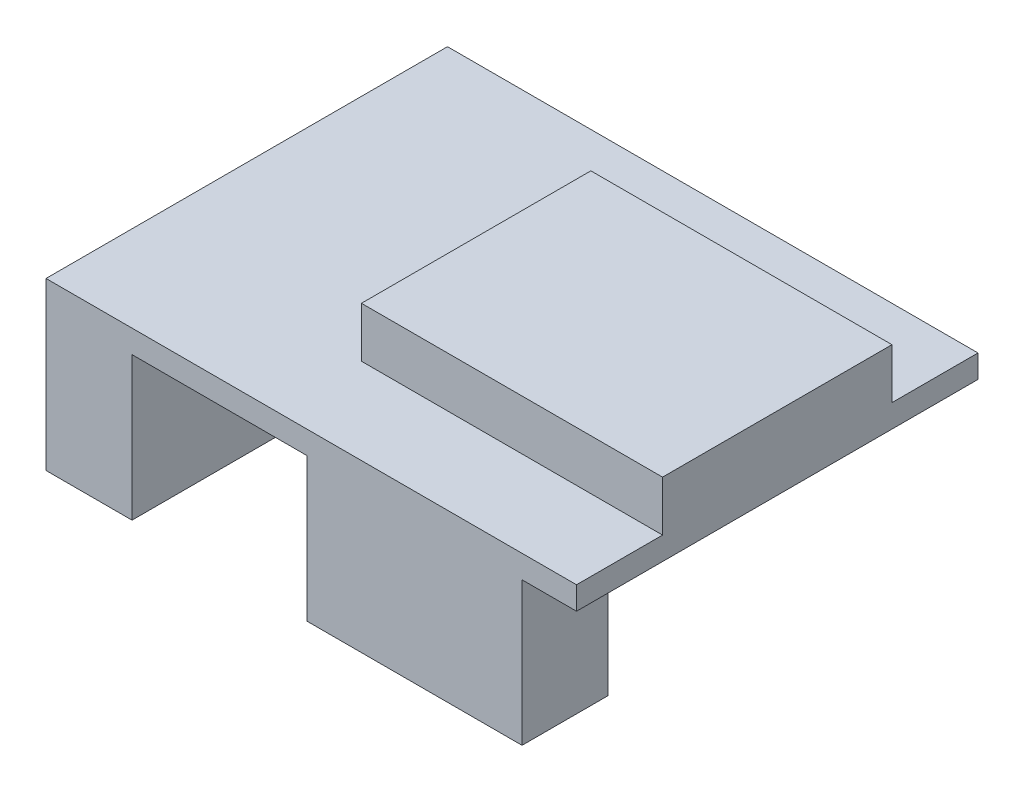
SolidWorks part; units mm, degrees
ref_plane "Спереди" through (0, 0, 0) normal (0, 0, 1) x (1, 0, 0)
ref_plane "Сверху" through (0, 0, 0) normal (0, 1, 0) x (1, 0, 0)
ref_plane "Справа" through (0, 0, 0) normal (1, 0, 0) x (0, 0, -1)
sketch "Эскиз1" plane through (0, 0, 0) normal (0, 1, 0) x (1, 0, 0)
  line L1 (-18.5, -14) -> (18.5, -14)
  line L2 (-18.5, -14) -> (-18.5, 14)
  line L3 (-18.5, 14) -> (18.5, 14)
  line L4 (18.5, -14) -> (18.5, 14)
  line L5 (-18.5, -14) -> (18.5, 14) construction
  line L6 (-18.5, 14) -> (18.5, -14) construction
  point P0 (0, 0)
  dimension "D1" = 37
  dimension "D2" = 28
extrude "Бобышка-Вытянуть1" add sketch "Эскиз1" along normal blind 1.6
sketch "Эскиз2" plane through (0, 1.6, 0) normal (0, 1, 0) x (1, 0, 0)
  line L0 (18.5, 0) -> (-18.5, 0) construction
  line L1 (18.5, -14) -> (18.5, 14) construction
  line L2 (-18.5, 14) -> (-18.5, -14) construction
  line L4 (-2.5, 8) -> (18.5, 8)
  line L5 (-2.5, 8) -> (-2.5, -8)
  line L6 (-2.5, -8) -> (18.5, -8)
  line L7 (18.5, 8) -> (18.5, -8)
  line L8 (-2.5, 8) -> (18.5, -8) construction
  line L9 (-2.5, -8) -> (18.5, 8) construction
  point P6 (8, 0)
  dimension "D1" = 21
  dimension "D2" = 16
extrude "Бобышка-Вытянуть2" add sketch "Эскиз2" along normal blind 3.5
sketch "Эскиз3" plane through (0, 1.6, 0) normal (0, 1, 0) x (1, 0, 0)
  line L6 (-18.5, -14) -> (18.5, -14) construction
  line L7 (-0.3, -14) -> (14.7, -14)
  line L8 (-0.3, -14) -> (-0.3, -8)
  line L9 (-0.3, -8) -> (14.7, -8)
  line L10 (14.7, -14) -> (14.7, -8)
  line L11 (18.5, -14) -> (18.5, -8) construction
  line L13 (-18.5, -14) -> (-12.5, -14)
  line L14 (-18.5, -14) -> (-18.5, 1)
  line L15 (-18.5, 1) -> (-12.5, 1)
  line L16 (-12.5, -14) -> (-12.5, 1)
  line L17 (-18.5, 14) -> (-12.5, 14)
  line L18 (-18.5, 14) -> (-18.5, 6.5868)
  line L19 (-18.5, 6.5868) -> (-12.5, 6.5868)
  line L20 (-12.5, 14) -> (-12.5, 6.5868)
  dimension "D1" = 3.8
  dimension "D2" = 15
  dimension "D3" = 6
  dimension "D4" = 6
  dimension "D5" = 15
extrude "Бобышка-Вытянуть3" add sketch "Эскиз3" against normal blind 10 from surface at -1.6
